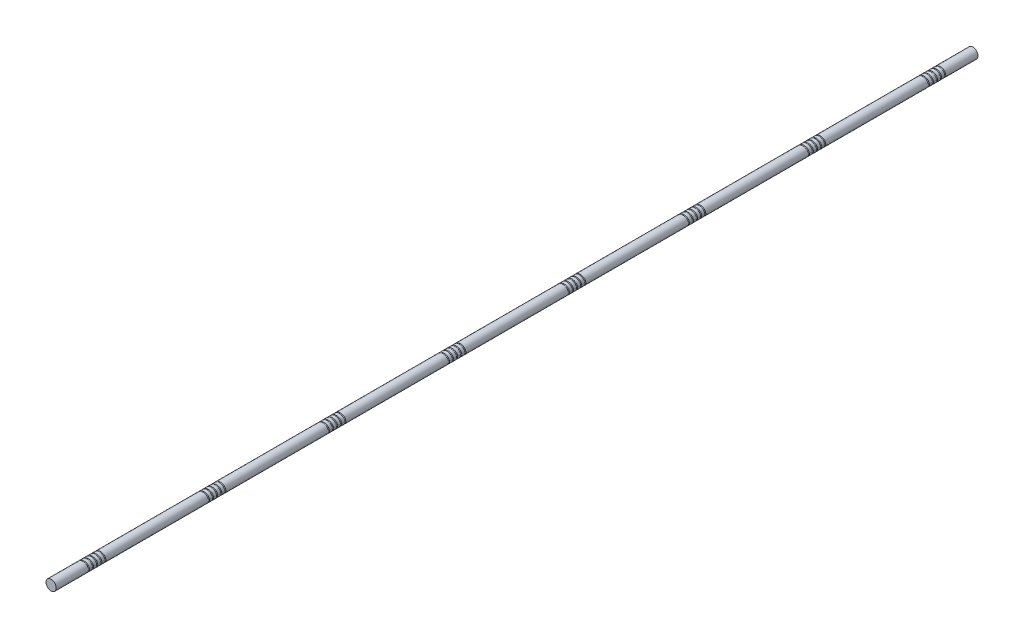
SolidWorks part; units mm, degrees
ref_plane "Front Plane" through (0, 0, 0) normal (0, 0, 1) x (1, 0, 0)
ref_plane "Top Plane" through (0, 0, 0) normal (0, 1, 0) x (1, 0, 0)
ref_plane "Right Plane" through (0, 0, 0) normal (1, 0, 0) x (0, 0, -1)
sketch "Sketch1" plane through (0, 0, 0) normal (0, 0, 1) x (1, 0, 0)
  circle A0 centre (0, 0) radius 25
  dimension "D1" = 50
extrude "Boss-Extrude1" add sketch "Sketch1" along normal blind 4500
ref_plane "Plane1" through (0, 0, 150) normal (0, 0, 1) x (1, 0, 0)
sketch "Sketch2" plane through (0, 0, 150) normal (0, 0, 1) x (1, 0, 0)
  circle A0 centre (0, 0) radius 27.1167
  dimension "D1" = 54.2333
curve "Helix/Spiral1"
sketch "Sketch3" plane through (0, 0, 0) normal (0, 1, 0) x (1, 0, 0)
  circle A0 centre (-27.1167, -150) radius 3.175
  spline S0 degree 3 number of poles 118 (-27.1167, -150) -> (-27.1167, -250) construction
  dimension "D1" = 6.35
sweep "Cut-Sweep1" cut profiles "Sketch3" path "Helix/Spiral1"
pattern_linear "LPattern1" count 8 spacing 585.7143 along (0, 0, -1) of "Cut-Sweep1"
